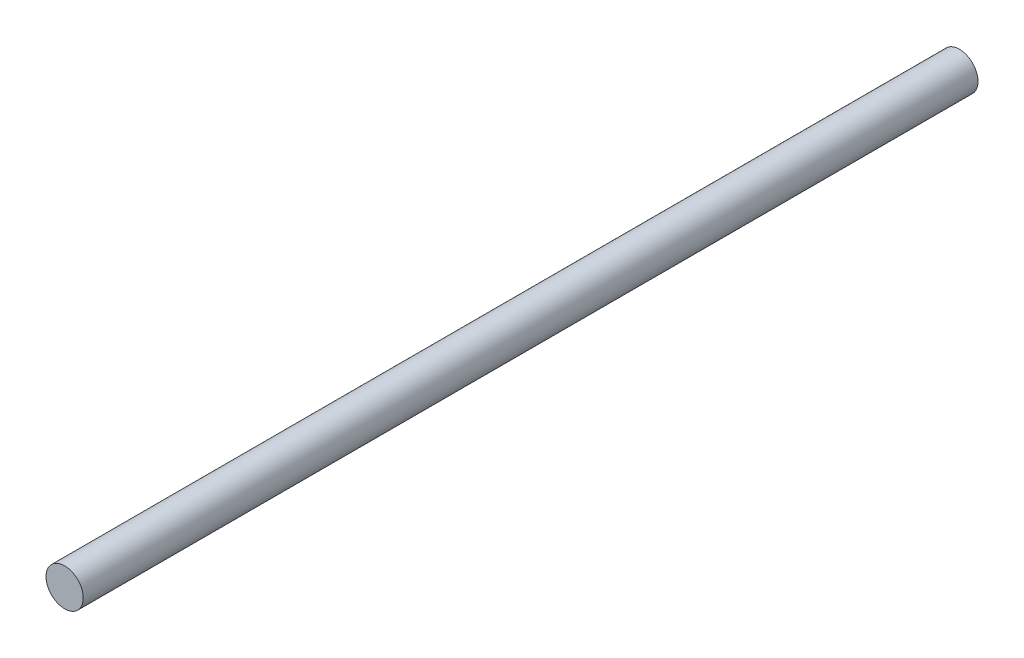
SolidWorks part; units mm, degrees
ref_plane "Front Plane" through (0, 0, 0) normal (0, 0, 1) x (1, 0, 0)
ref_plane "Top Plane" through (0, 0, 0) normal (0, 1, 0) x (1, 0, 0)
ref_plane "Right Plane" through (0, 0, 0) normal (1, 0, 0) x (0, 0, -1)
ref_plane "Plane1" [suppressed] through (23.8125, 0, 0) normal (1, 0, 0) x (0, 0, -1)
ref_plane "Plane2" [suppressed] through (19.05, 0, 0) normal (1, 0, 0) x (0, 0, -1)
sketch "Sketch1" plane through (0, 0, 0) normal (0, 0, 1) x (1, 0, 0)
  circle A0 centre (0, 0) radius 12.7
  dimension "D1" = 25.4
extrude "Boss-Extrude1" add sketch "Sketch1" along normal mid plane 609.6
sketch "Sketch4" plane through (0, 0, -304.8) normal (0, 0, -1) x (-1, 0, 0)
  circle A0 centre (0, 0) radius 12.7
  circle A1 centre (0, 0) radius 12.7 construction
extrude "Cut-Extrude1" [suppressed] cut sketch "Sketch4" against normal blind 101.6
sketch "Sketch2" [suppressed] plane through (0, 0, 0) normal (1, 0, 0) x (0, 0, -1)
  line L0 (0, 0) -> (793.9246, 0) construction
  line L1 (774.6345, -315.2532) -> (1621.5208, -804.2032)
  line L2 (334.6936, -61.2532) -> (774.6345, -315.2532)
  line L3 (101.6, 0) -> (106.0936, 0)
  line L5 (1843.1749, -1279.5419) -> (1800.9313, -1519.1172)
  line L6 (1746.624, -1668.3252) -> (1265.8574, -2501.0374)
  line L7 (101.6, -12.7) -> (101.6, 12.7) construction
  arc A0 (106.0936, 0) -> (334.6936, -61.2532) centre (106.0936, -457.2) cw
  arc A1 (1621.5208, -804.2032) -> (1843.1749, -1279.5419) centre (1392.9208, -1200.15) cw
  arc A2 (1800.9313, -1519.1172) -> (1746.624, -1668.3252) centre (1350.6772, -1439.7252) cw
  dimension "D1" = 457.2
  dimension "D5" = 110
  dimension "D6" = 685.8
  dimension "D2" = 30
  dimension "D3" = 114.3
  dimension "D4" = 1485.9
  dimension "D7" = 508
sketch "Sketch3" [suppressed] plane through (0, 0, -101.6) normal (0, 0, -1) x (-1, 0, 0)
  circle A0 centre (0, 0) radius 12.7
  circle A2 centre (0, 0) radius 12.7 construction
sketch "Sketch5" plane through (0, 0, 304.8) normal (0, 0, 1) x (1, 0, 0)
  circle A0 centre (0, 0) radius 12.7
  circle A1 centre (0, 0) radius 12.7 construction
extrude "Boss-Extrude2" [suppressed] add sketch "Sketch5" along normal blind 457.2
sketch3d "3DSketch1" [suppressed]
  line L0 (23.8125, -1239.2525, -1796.8758) -> (23.8125, -1531.8428, -1745.2843)
  line L1 (19.05, -146.4474, -482.2543) -> (19.05, -324.2474, -790.2129)
  line L2 (19.05, -324.2474, -790.2129) -> (23.8125, -392.4375, -908.3216)
  line L3 (23.8125, -392.4375, -908.3216) -> (23.8125, -612.7708, -1340.7502)
  line L4 (0, -315.2532, -774.6345) -> (0, -804.2032, -1621.5208) construction
  line L5 (19.05, -324.2474, -790.2129) -> (23.8125, -324.2474, -790.2129) construction
  line L6 (23.8125, -324.2474, -790.2129) -> (23.8125, -392.4375, -908.3216) construction
  line L7 (23.8125, -392.4375, -908.3216) -> (0, -392.4375, -908.3216) construction
  line L8 (23.8125, -612.7708, -1340.7502) -> (23.8125, -768.9646, -1611.2857)
  line L9 (0, 0, -101.6) -> (0, 0, -114.3)
  line L10 (19.05, -146.4474, -482.2543) -> (0, -61.2532, -334.6936)
  line L11 (0, -61.2532, -334.6936) -> (0, -315.2532, -774.6345) construction
  line L12 (23.8125, -392.4375, -908.3216) -> (23.8125, -370.4404, -921.0216) construction
  line L13 (23.8125, -370.4404, -921.0216) -> (23.8125, -942.706, -1912.2147) construction
  line L14 (0, -1279.5419, -1843.1749) -> (0, -1519.1172, -1800.9313) construction
  line L15 (23.8125, -1664.4722, -1697.0111) -> (23.8125, -2443.7104, -1247.1177)
  line L16 (0, -1668.3252, -1746.624) -> (0, -2501.0374, -1265.8574) construction
  arc A0 (0, 0, -114.3) -> (0, -61.2532, -334.6936) centre (0, -427.1231, -114.3) cw
  arc A2 (23.8125, -768.9646, -1611.2857) -> (23.8125, -1239.2525, -1796.8758) centre (23.8125, -1120.9173, -1408.0857) cw
  arc A3 (23.8125, -1531.8428, -1745.2843) -> (23.8125, -1664.4722, -1697.0111) centre (23.8125, -1461.2722, -1345.0584) cw
  point P4 (-427.1231, -427.1231, -114.3)
  point P23 (-382.5875, -1120.9173, -1408.0857)
  point P27 (-382.5875, -1461.2722, -1345.0584)
  dimension "D1" = 171.45
  dimension "D4" = 25.4
  dimension "D6" = 3
  dimension "D7" = 406.4
  dimension "D3" = 355.6
  dimension "D2" = 2
  dimension "D5" = 12.7
  dimension "D8" = 312.3875
  dimension "D9" = 1632.4564
  dimension "D10" = 899.7868
  dimension "D11" = 297.104
sweep "Sweep2" [suppressed] add profiles "Sketch3" path "3DSketch1"
